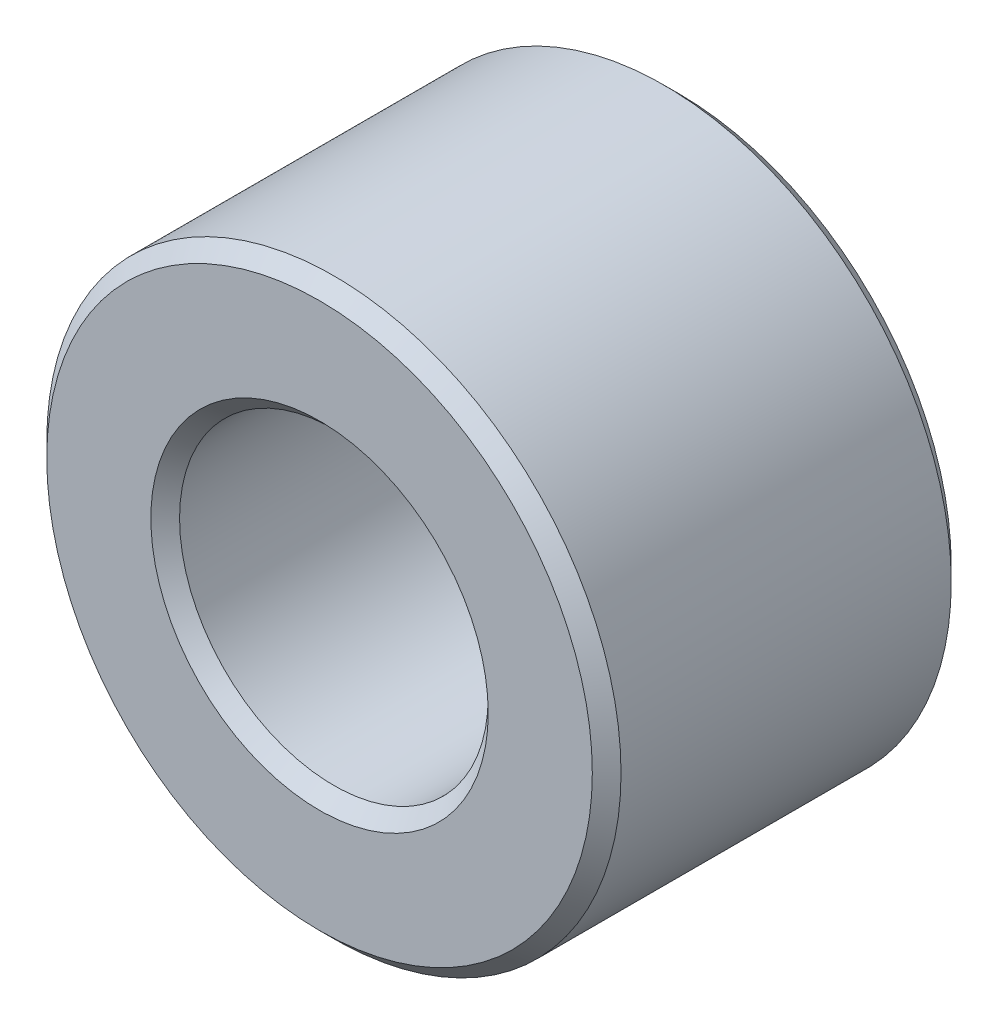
SolidWorks part; units mm, degrees
ref_plane "Front Plane" through (0, 0, 0) normal (0, 0, 1) x (1, 0, 0)
ref_plane "Top Plane" through (0, 0, 0) normal (0, 1, 0) x (1, 0, 0)
ref_plane "Right Plane" through (0, 0, 0) normal (1, 0, 0) x (0, 0, -1)
sketch "Sketch1" plane through (0, 0, 0) normal (0, 0, 1) x (1, 0, 0)
  circle A0 centre (0, 0) radius 4
  circle A1 centre (0, 0) radius 2.15
  dimension "D1" = 8
  dimension "D2" = 4.3
extrude "Boss-Extrude2" add sketch "Sketch1" along normal mid plane 5
chamfer "Chamfer3" distance 0.2 angle 45 4 edges at (4, 0, 2.5) (4, 0, -2.5) (2.15, 0, -2.5) (2.15, 0, 2.5)
